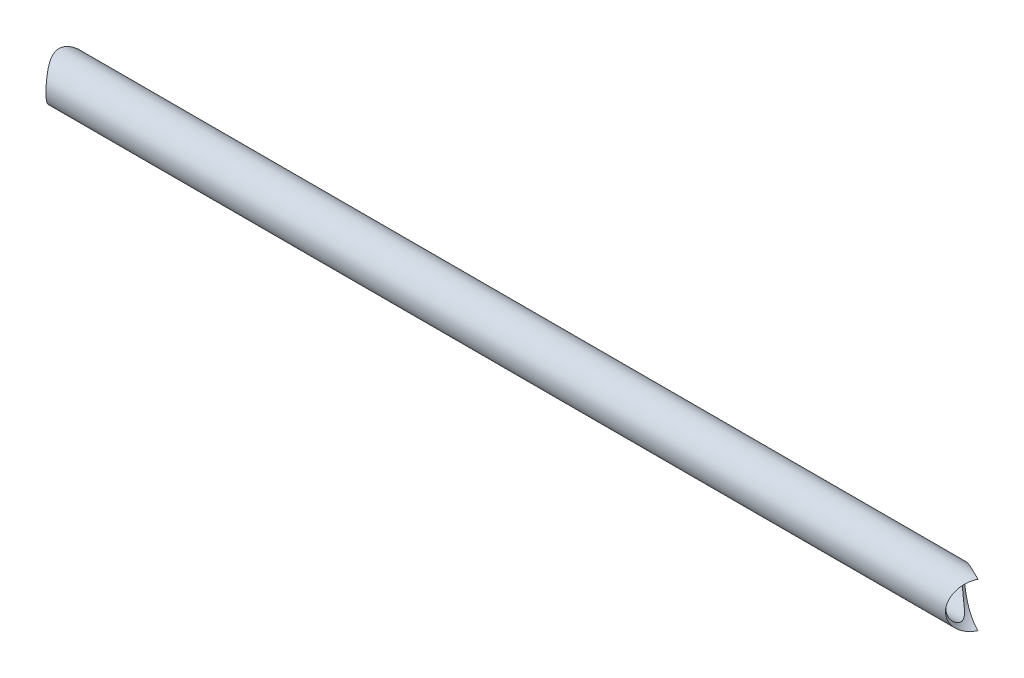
SolidWorks part; units mm, degrees
ref_plane "Plan1" through (0, 0, 0) normal (0, 0, 1) x (1, 0, 0)
ref_plane "Plan2" through (0, 0, 0) normal (0, 1, 0) x (1, 0, 0)
ref_plane "Plan3" through (0, 0, 0) normal (1, 0, 0) x (0, 0, -1)
sketch "Esquisse2" plane through (0, 0, 0) normal (1, 0, 0) x (0, 0, -1)
  line L0 (950, -10) -> (950, 10) construction
  line L1 (50, 0) -> (-50, 0) construction
  circle A0 centre (885, 0) radius 10
  circle A1 centre (885, 0) radius 8.5
  dimension "D1" = 20
  dimension "D2" = 65
  dimension "D3" = 1.5
extrude "Base-Extrusion" add sketch "Esquisse2" against normal up to surface (179 mm away)
sketch "Esquisse3" plane through (0, 0, 0) normal (1, 0, 0) x (0, 0, -1)
  circle A0 centre (885, 0) radius 8.5 construction
  circle A1 centre (885, 0) radius 10
  circle A2 centre (885, 0) radius 10
  circle A3 centre (885, 0) radius 8.5
  dimension "D1" = 0
extrude "Boss.-Extru.1" add sketch "Esquisse3" along normal up to surface (213.6098 mm away)
